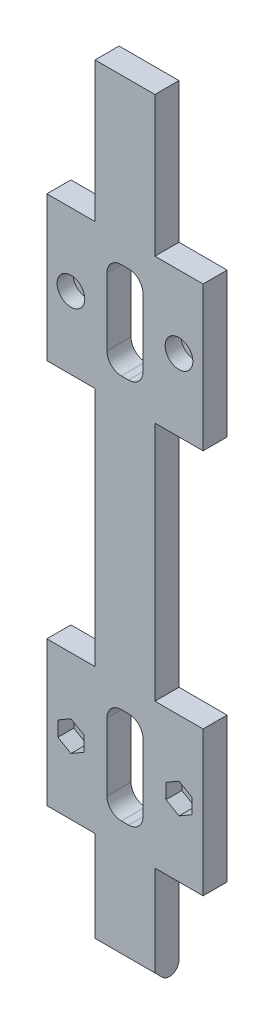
SolidWorks part; units mm, degrees
ref_plane "Alzado" through (0, 0, 0) normal (0, 0, 1) x (1, 0, 0)
ref_plane "Planta" through (0, 0, 0) normal (0, 1, 0) x (1, 0, 0)
ref_plane "Vista lateral" through (0, 0, 0) normal (1, 0, 0) x (0, 0, -1)
sketch "Croquis1" plane through (0, 0, 0) normal (0, 0, 1) x (1, 0, 0)
  line L18 (-11.9782, 78.7738) -> (-11.9782, 107.8423)
  line L19 (0.4531, 78.7738) -> (0.4531, 107.8423)
  line L20 (10.4531, 78.7738) -> (0.4531, 78.7738)
  line L21 (-11.9782, 78.7738) -> (-21.9782, 78.7738)
  line L22 (-21.9782, 48.7738) -> (-11.9782, 48.7738)
  line L23 (-21.9782, 78.7738) -> (-21.9782, 48.7738)
  line L24 (10.4531, 48.7738) -> (10.4531, 78.7738)
  line L25 (0.4531, 48.7738) -> (10.4531, 48.7738)
  line L26 (0.4531, -1.2262) -> (0.4531, 48.7738)
  line L27 (-11.9782, -1.2262) -> (-11.9782, 48.7738)
  line L28 (-11.9782, -1.2262) -> (-21.9782, -1.2262)
  line L29 (-21.9782, -1.2262) -> (-21.9782, -31.2262)
  line L30 (-21.9782, -31.2262) -> (-11.9782, -31.2262)
  line L31 (-11.9782, -65.0867) -> (-11.9782, -31.2262)
  line L32 (0.4531, -65.0867) -> (0.4531, -31.2262)
  line L33 (10.4531, -31.2262) -> (10.4531, -1.2262)
  line L34 (0.4531, -31.2262) -> (10.4531, -31.2262)
  line L35 (10.4531, -1.2262) -> (0.4531, -1.2262)
  line L36 (-11.9782, 107.8423) -> (0.4531, 107.8423)
  line L37 (0.4531, -65.0867) -> (-11.9782, -65.0867)
extrude "Saliente-Extruir1" add sketch "Croquis1" against normal blind 5
sketch "Croquis2" plane through (-11.9782, 0, 0) normal (-1, 0, 0) x (0, 0, 1)
  line L0 (-5, -65.0867) -> (-1.4645, -68.6222)
  line L1 (-5, -65.0867) -> (0, -65.0867)
  arc A1 (-1.4645, -68.6222) -> (0, -65.0867) centre (-5, -65.0867) ccw
extrude "Saliente-Extruir2" add sketch "Croquis2" against normal up to surface (12.4313 mm away)
sketch "Croquis3" plane through (-11.9782, 0, 0) normal (-1, 0, 0) x (0, 0, 1)
  line L0 (-15, -65.0867) -> (-5, -55.0867)
  line L1 (-5, -31.2262) -> (-5, -65.0867) construction
  line L2 (-5, -55.0867) -> (0, -50.0867)
  line L3 (0, -31.2262) -> (0, -65.0867) construction
  line L4 (0, -50.0867) -> (0, -72.0397)
  line L5 (0, -72.0397) -> (-15, -65.0867)
extrude "Cortar-Extruir1" cut sketch "Croquis3" against normal through all
fillet "Redondeo1" radius 2 1 edges at (-5.7626, -55.0867, -5)
sketch "Croquis4" plane through (0, 0, 0) normal (0, 0, 1) x (1, 0, 0)
  line L0 (5.4531, 78.7738) -> (5.4531, 48.7738) construction
  line L1 (10.4531, 78.7738) -> (0.4531, 78.7738) construction
  line L2 (0.4531, 48.7738) -> (10.4531, 48.7738) construction
  line L3 (5.4531, 48.7738) -> (-16.9782, 78.7738) construction
  line L4 (-11.9782, 78.7738) -> (-21.9782, 78.7738) construction
  line L5 (-16.9782, 78.7738) -> (-16.9782, 48.7738) construction
  line L6 (-21.9782, 48.7738) -> (-11.9782, 48.7738) construction
  line L7 (-16.9782, -31.2262) -> (-16.9782, -1.2262) construction
  line L8 (-21.9782, -31.2262) -> (-11.9782, -31.2262) construction
  line L9 (-11.9782, -1.2262) -> (-21.9782, -1.2262) construction
  line L10 (-16.9782, -1.2262) -> (5.4531, -31.2262) construction
  line L11 (0.4531, -31.2262) -> (10.4531, -31.2262) construction
  line L12 (5.4531, -31.2262) -> (5.4531, -1.2262) construction
  line L13 (10.4531, -1.2262) -> (0.4531, -1.2262) construction
  circle A0 centre (-16.9782, -16.2262) radius 1.55
  circle A1 centre (5.4531, -16.2262) radius 1.55
  circle A2 centre (5.4531, 63.7738) radius 1.55
  circle A3 centre (-16.9782, 63.7738) radius 1.55
  dimension "D1" = 3.1
extrude "Cortar-Extruir2" cut sketch "Croquis4" against normal through all
sketch "Croquis5" plane through (0, 0, 0) normal (0, 0, 1) x (1, 0, 0)
  line L13 (-16.9782, -13.1062) -> (-19.6802, -14.6662)
  line L14 (-19.6802, -14.6662) -> (-19.6802, -17.7862)
  line L15 (-19.6802, -17.7862) -> (-16.9782, -19.3462)
  line L16 (-16.9782, -19.3462) -> (-14.2762, -17.7862)
  line L17 (-14.2762, -17.7862) -> (-14.2762, -14.6662)
  line L18 (-14.2762, -14.6662) -> (-16.9782, -13.1062)
  line L19 (5.4531, -13.1062) -> (2.7511, -14.6662)
  line L20 (2.7511, -14.6662) -> (2.7511, -17.7862)
  line L21 (2.7511, -17.7862) -> (5.4531, -19.3462)
  line L22 (5.4531, -19.3462) -> (8.1551, -17.7862)
  line L23 (8.1551, -17.7862) -> (8.1551, -14.6662)
  line L24 (8.1551, -14.6662) -> (5.4531, -13.1062)
  circle A0 centre (-16.9782, -16.2262) radius 2.702 construction
  circle A1 centre (5.4531, -16.2262) radius 2.702 construction
  circle A6 centre (5.4531, 63.7738) radius 2.875
  circle A7 centre (-16.9782, 63.7738) radius 2.875
  dimension "D1" = 5.75
  dimension "D2" = 6.24
extrude "Cortar-Extruir3" cut sketch "Croquis5" against normal blind 3.3
sketch "Croquis6" plane through (0, 0, 0) normal (0, 0, 1) x (1, 0, 0)
  line L0 (-5.7626, 73.7738) -> (-5.7626, 107.8423) construction
  line L1 (-9.5126, -6.2262) -> (-2.0126, -6.2262)
  line L2 (-9.5126, -6.2262) -> (-9.5126, -26.2262)
  line L3 (-9.5126, -26.2262) -> (-2.0126, -26.2262)
  line L4 (-2.0126, -6.2262) -> (-2.0126, -26.2262)
  line L5 (-9.5126, 73.7738) -> (-2.0126, 73.7738)
  line L6 (-9.5126, 73.7738) -> (-9.5126, 53.7738)
  line L7 (-9.5126, 53.7738) -> (-2.0126, 53.7738)
  line L8 (-2.0126, 73.7738) -> (-2.0126, 53.7738)
  line L9 (0.4531, 107.8423) -> (-11.9782, 107.8423) construction
  line L10 (10.4531, 63.7738) -> (-2.0126, 63.7738) construction
  line L11 (10.4531, 48.7738) -> (10.4531, 78.7738) construction
  line L12 (10.4531, -16.2262) -> (-2.0126, -16.2262) construction
  line L13 (10.4531, -31.2262) -> (10.4531, -1.2262) construction
  dimension "D1" = 7.5
  dimension "D2" = 20
extrude "Cortar-Extruir4" cut sketch "Croquis6" against normal through all
fillet "Redondeo2" radius 3 8 edges at (-9.5126, -6.2262, -2.5) (-2.0126, -6.2262, -2.5) (-2.0126, -26.2262, -2.5) (-9.5126, -26.2262, -2.5) (-9.5126, 53.7738, -2.5) (-2.0126, 53.7738, -2.5) (-2.0126, 73.7738, -2.5) (-9.5126, 73.7738, -2.5)
